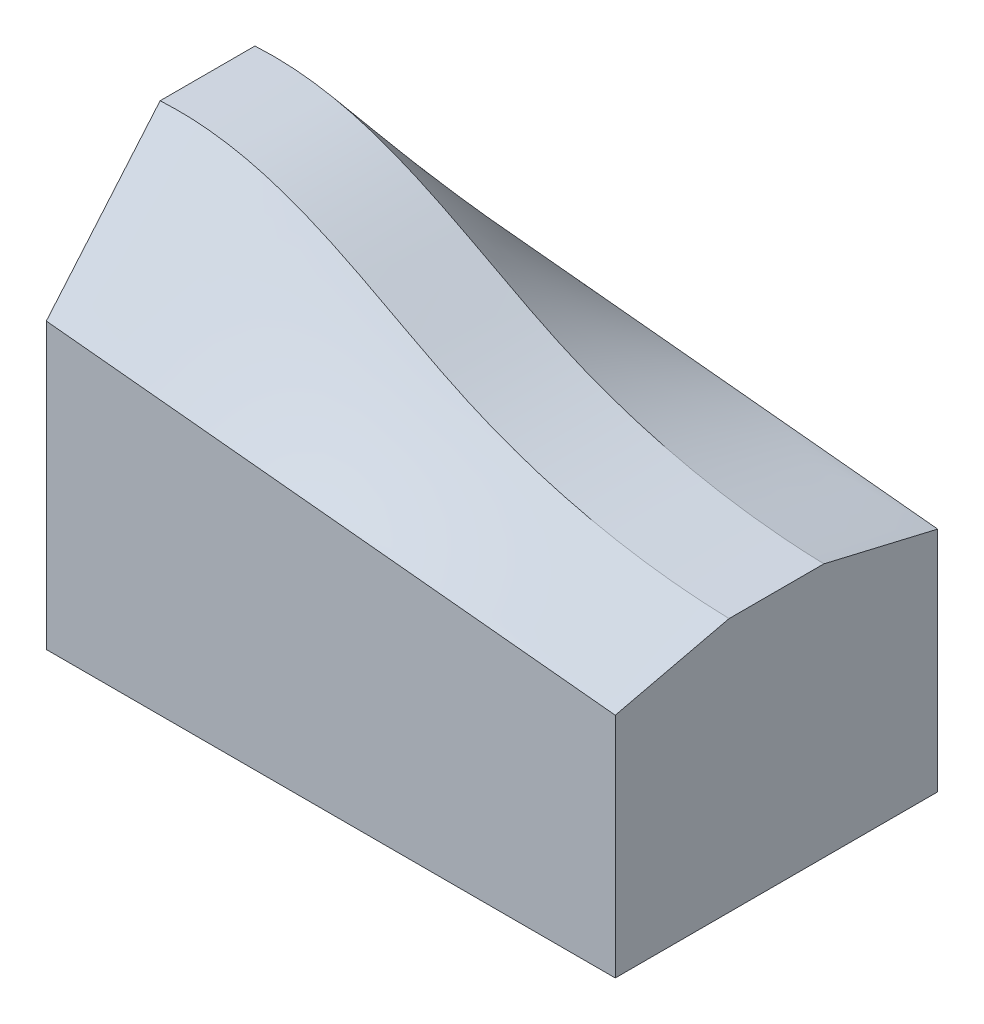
SolidWorks part; units mm, degrees
ref_plane "Front Plane" through (0, 0, 0) normal (0, 0, 1) x (1, 0, 0)
ref_plane "Top Plane" through (0, 0, 0) normal (0, 1, 0) x (1, 0, 0)
ref_plane "Right Plane" through (0, 0, 0) normal (1, 0, 0) x (0, 0, -1)
sketch "Sketch1" plane through (0, 0, 0) normal (1, 0, 0) x (0, 0, -1)
  line L0 (-8.5, 6) -> (0, 8)
  line L1 (-8.5, -6) -> (8.5, -6)
  line L2 (-8.5, -6) -> (-8.5, 6)
  line L3 (-8.5, 6) -> (8.5, 6) construction
  line L4 (8.5, -6) -> (8.5, 6)
  line L5 (-8.5, -6) -> (8.5, 6) construction
  line L6 (-8.5, 6) -> (8.5, -6) construction
  line L7 (0, 8) -> (8.5, 6)
  line L8 (0, 8) -> (0, 0) construction
  point P0 (0, 0)
  dimension "D1" = 17
  dimension "D2" = 12
  dimension "D3" = 14
ref_plane "Plane1" through (-30, 0, 0) normal (1, 0, 0) x (0, 0, -1)
sketch "Sketch2" plane through (-30, 0, 0) normal (1, 0, 0) x (0, 0, -1)
  line L0 (-8.5, 9) -> (0, 19)
  line L1 (-8.5, -6) -> (8.5, -6)
  line L2 (-8.5, -6) -> (-8.5, 9)
  line L3 (-8.5, 9) -> (8.5, 9) construction
  line L4 (8.5, -6) -> (8.5, 9)
  line L7 (0, 19) -> (8.5, 9)
  line L8 (0, 19) -> (0, 0) construction
  point P0 (0, 0)
  dimension "D1" = 17
  dimension "D2" = 6
  dimension "D3" = 15
  dimension "D4" = 25
sketch "Sketch3" plane through (0, 0, 0) normal (0, 0, 1) x (1, 0, 0)
  spline S0 degree 3 poles (-30, 19) (-22.8511, 19.7948) (-15.7093, 10.6022) (-4.6735, 7.9948) (0, 8) knots 0 0 0 0 0.565401 1 1 1 1
loft "Loft1" add profiles "Sketch1", "Sketch2"
fillet "Chamfer1" radius 5 3 edges
